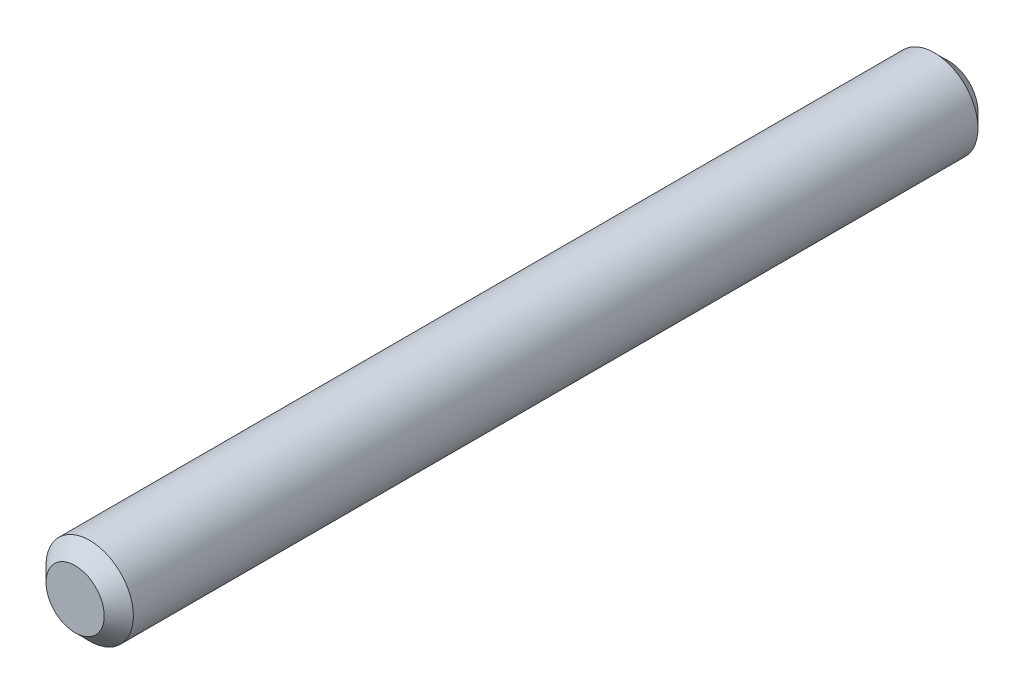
SolidWorks part; units mm, degrees
ref_plane "Plan de face" through (0, 0, 0) normal (0, 0, 1) x (1, 0, 0)
ref_plane "Plan de dessus" through (0, 0, 0) normal (0, 1, 0) x (1, 0, 0)
ref_plane "Plan de droite" through (0, 0, 0) normal (1, 0, 0) x (0, 0, -1)
sketch "Esquisse1" plane through (0, 0, 0) normal (0, 0, 1) x (1, 0, 0)
  circle A0 centre (0, 0) radius 1.5
  dimension "D1" = 3
extrude "Boss.-Extru.1" add sketch "Esquisse1" along normal mid plane 30
chamfer "Chanfrein1" distance 0.5 angle 45 2 edges at (1.5, 0, -15) (1.5, 0, 15)
